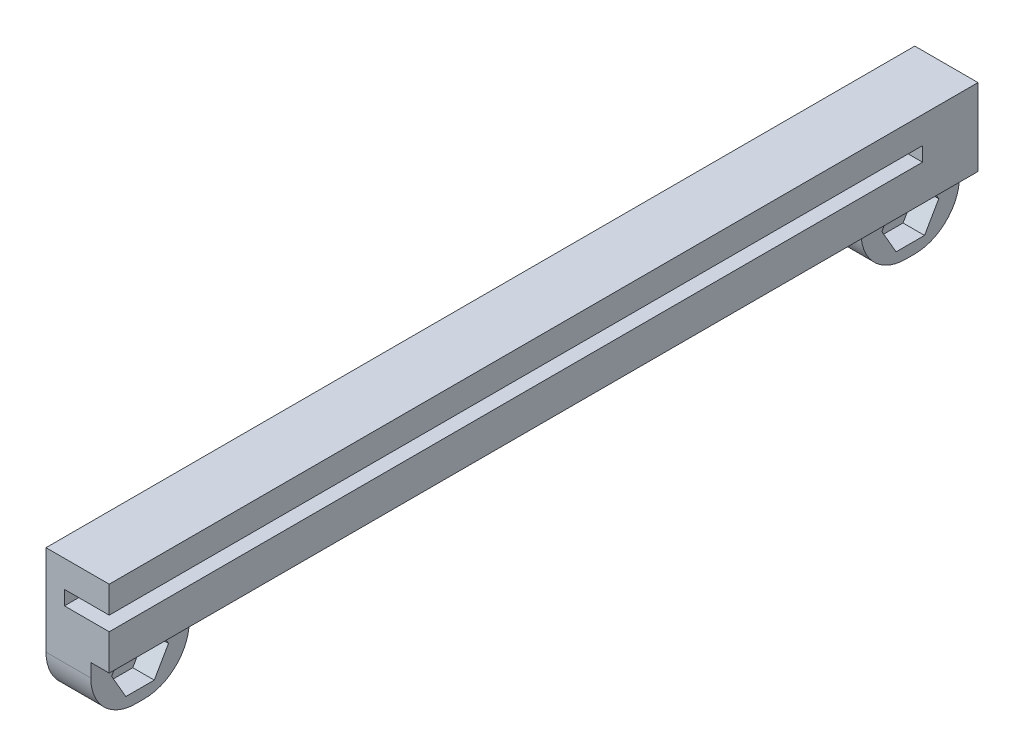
SolidWorks part; units mm, degrees
ref_plane "Front Plane" through (0, 0, 0) normal (0, 0, 1) x (1, 0, 0)
ref_plane "Top Plane" through (0, 0, 0) normal (0, 1, 0) x (1, 0, 0)
ref_plane "Right Plane" through (0, 0, 0) normal (1, 0, 0) x (0, 0, -1)
sketch "Sketch1" plane through (0, 0, 0) normal (0, 1, 0) x (1, 0, 0)
  line L1 (-3.5288, -48.5) -> (3.5288, -48.5)
  line L2 (-3.5288, -48.5) -> (-3.5288, 48.5)
  line L3 (-3.5288, 48.5) -> (3.5288, 48.5)
  line L4 (3.5288, -48.5) -> (3.5288, 48.5)
  line L5 (-3.5288, -48.5) -> (3.5288, 48.5) construction
  line L6 (-3.5288, 48.5) -> (3.5288, -48.5) construction
  point P0 (0, 0)
  dimension "D1" = 97
  dimension "D2" = 7.0575
extrude "Boss-Extrude2" add sketch "Sketch1" along normal blind 7.6
sketch "Sketch4" plane through (0, 7.6, 0) normal (0, 1, 0) x (1, 0, 0)
  line L0 (3.5288, -48.5) -> (3.5288, 48.5) construction
  line L1 (3.5288, 42.305) -> (-1.4713, 42.305)
  line L2 (3.5288, 42.305) -> (3.5288, -48.5)
  line L3 (3.5288, -48.5) -> (-1.4713, -48.5)
  line L4 (-1.4713, 42.305) -> (-1.4713, -48.5)
  line L5 (-3.5288, -48.5) -> (3.5288, -48.5) construction
  line L7 (-3.5288, 48.5) -> (-3.5288, -48.5) construction
  dimension "D1" = 90.805
  dimension "D2" = 2.0575
extrude "Cut-Extrude1" cut sketch "Sketch4" against normal blind 4.6
sketch "Sketch6" plane through (0, 7.6, 0) normal (0, 1, 0) x (1, 0, 0)
  line L1 (3.5288, 42.305) -> (-1.4713, 42.305)
  line L2 (3.5288, 42.305) -> (3.5288, -48.5)
  line L3 (3.5288, -48.5) -> (-1.4713, -48.5)
  line L4 (-1.4713, 42.305) -> (-1.4713, -48.5)
extrude "Boss-Extrude3" add sketch "Sketch6" against normal blind 3
sketch "Sketch8" plane through (0, 0, 0) normal (0, -1, 0) x (1, 0, 0)
  line L1 (-3.5288, 48.5) -> (3.5287, 48.5)
  line L2 (-3.5288, 48.5) -> (-3.5287, -48.5)
  line L3 (-3.5287, -48.5) -> (3.5288, -48.5)
  line L4 (3.5287, 48.5) -> (3.5288, -48.5)
extrude "Boss-Extrude4" add sketch "Sketch8" along normal blind 1
sketch "Sketch9" plane through (0, -1, 0) normal (0, -1, 0) x (1, 0, 0)
  line L1 (-3.5288, 48.5) -> (1.4712, 48.5)
  line L2 (-3.5288, 48.5) -> (-3.5288, 37.5)
  line L3 (-3.5288, 37.5) -> (1.4712, 37.5)
  line L4 (1.4712, 48.5) -> (1.4712, 37.5)
  line L5 (-3.5287, -48.5) -> (1.4713, -48.5)
  line L6 (-3.5287, -48.5) -> (-3.5287, -37.5)
  line L7 (-3.5287, -37.5) -> (1.4713, -37.5)
  line L8 (1.4713, -48.5) -> (1.4713, -37.5)
  point P10 (1.4713, -43)
  dimension "D1" = 11
  dimension "D2" = 11
  dimension "D3" = 5
  dimension "D4" = 5
extrude "Boss-Extrude5" add sketch "Sketch9" along normal blind 6.5 contours L2 L1 L4 L3 | L6 L5 L8 L7
sketch "Sketch10" plane through (1.4713, 0, 0) normal (1, 0, 0) x (0, 0, -1)
  line L0 (-48.5, -7.5) -> (-48.5, -1) construction
  line L1 (-44.5877, -0.75) -> (-46.1754, -3.5)
  line L2 (-46.1754, -3.5) -> (-44.5877, -6.25)
  line L3 (-44.5877, -6.25) -> (-41.4123, -6.25)
  line L4 (-41.4123, -6.25) -> (-39.8246, -3.5)
  line L5 (-39.8246, -3.5) -> (-41.4123, -0.75)
  line L6 (-41.4123, -0.75) -> (-44.5877, -0.75)
  line L7 (-48.5, -7.5) -> (-37.5, -7.5) construction
  line L8 (37.5, -7.5) -> (37.5, -1) construction
  line L9 (46.1754, -3.5) -> (44.5877, -0.75)
  line L10 (44.5877, -0.75) -> (41.4123, -0.75)
  line L11 (41.4123, -0.75) -> (39.8246, -3.5)
  line L12 (39.8246, -3.5) -> (41.4123, -6.25)
  line L13 (41.4123, -6.25) -> (44.5877, -6.25)
  line L14 (44.5877, -6.25) -> (46.1754, -3.5)
  line L15 (48.5, -7.5) -> (37.5, -7.5) construction
  circle A0 centre (-43, -3.5) radius 2.75 construction
  circle A1 centre (43, -3.5) radius 2.75 construction
  dimension "D1" = 5.5
  dimension "D2" = 5.5
  dimension "D3" = 1.25
  dimension "D4" = 5.5
  dimension "D5" = 1.25
  dimension "D6" = 5.5
extrude "Cut-Extrude2" cut sketch "Sketch10" against normal blind 2.4
sketch "Sketch11" plane through (-0.9287, 0, 0) normal (1, 0, 0) x (0, 0, -1)
  line L2 (-48.5, -7.5) -> (-37.5, -7.5) construction
  line L3 (-48.5, -7.5) -> (-48.5, -1) construction
  line L4 (37.5, -7.5) -> (37.5, -1) construction
  line L5 (48.5, -7.5) -> (37.5, -7.5) construction
  circle A0 centre (-43, -3.5) radius 1.6
  circle A1 centre (43, -3.5) radius 1.6
  dimension "D3" = 3.2
  dimension "D4" = 3.2
  dimension "D1" = 4
  dimension "D2" = 5.5
  dimension "D5" = 5.5
  dimension "D6" = 4
extrude "Cut-Extrude3" cut sketch "Sketch11" against normal through all contours A0 | A1
fillet "Fillet2" radius 5 4 edges at (-1.0287, -7.5, -48.5) (-1.0287, -7.5, -37.5) (-1.0288, -7.5, 37.5) (-1.0288, -7.5, 48.5)
mirror "Mirror2" [suppressed]
delete or keep bodies "Body-Delete/Keep 1" [suppressed] type delete bodies bodies 109
